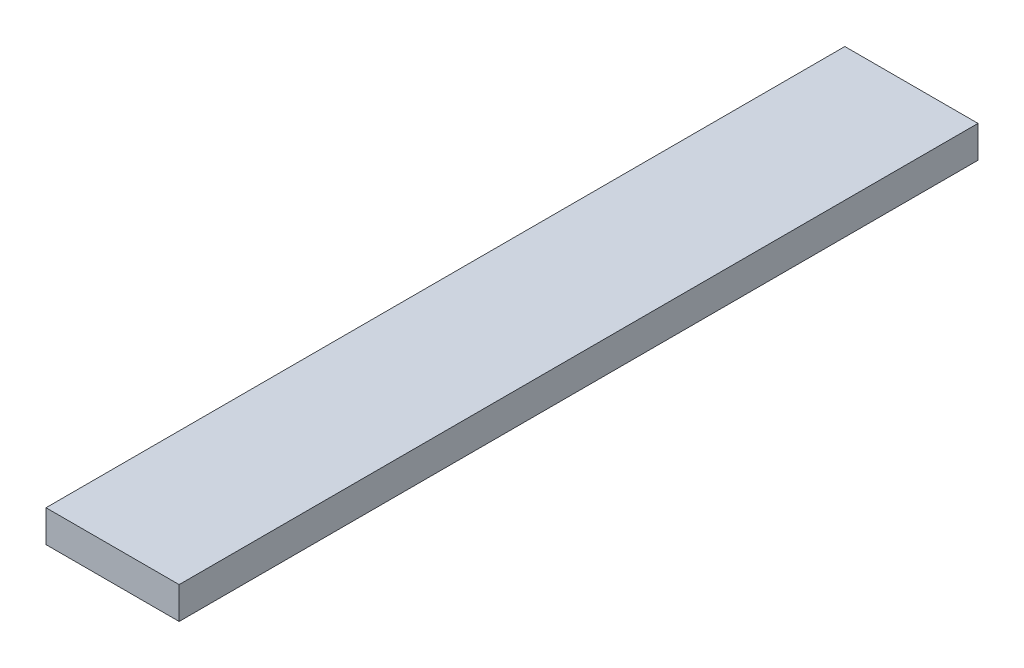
SolidWorks part; units mm, degrees
ref_plane "前视基准面" through (0, 0, 0) normal (0, 0, 1) x (1, 0, 0)
ref_plane "上视基准面" through (0, 0, 0) normal (0, 1, 0) x (1, 0, 0)
ref_plane "右视基准面" through (0, 0, 0) normal (1, 0, 0) x (0, 0, -1)
sketch "草图1" plane through (0, 0, 0) normal (0, 0, 1) x (1, 0, 0)
  line L1 (-25, 6) -> (25, 6)
  line L2 (-25, 6) -> (-25, -6)
  line L3 (-25, -6) -> (25, -6)
  line L4 (25, 6) -> (25, -6)
  line L5 (-25, 6) -> (25, -6) construction
  line L6 (-25, -6) -> (25, 6) construction
  point P0 (0, 0)
  dimension "D1" = 50
  dimension "D2" = 12
extrude "凸台-拉伸1" add sketch "草图1" along normal mid plane 300
